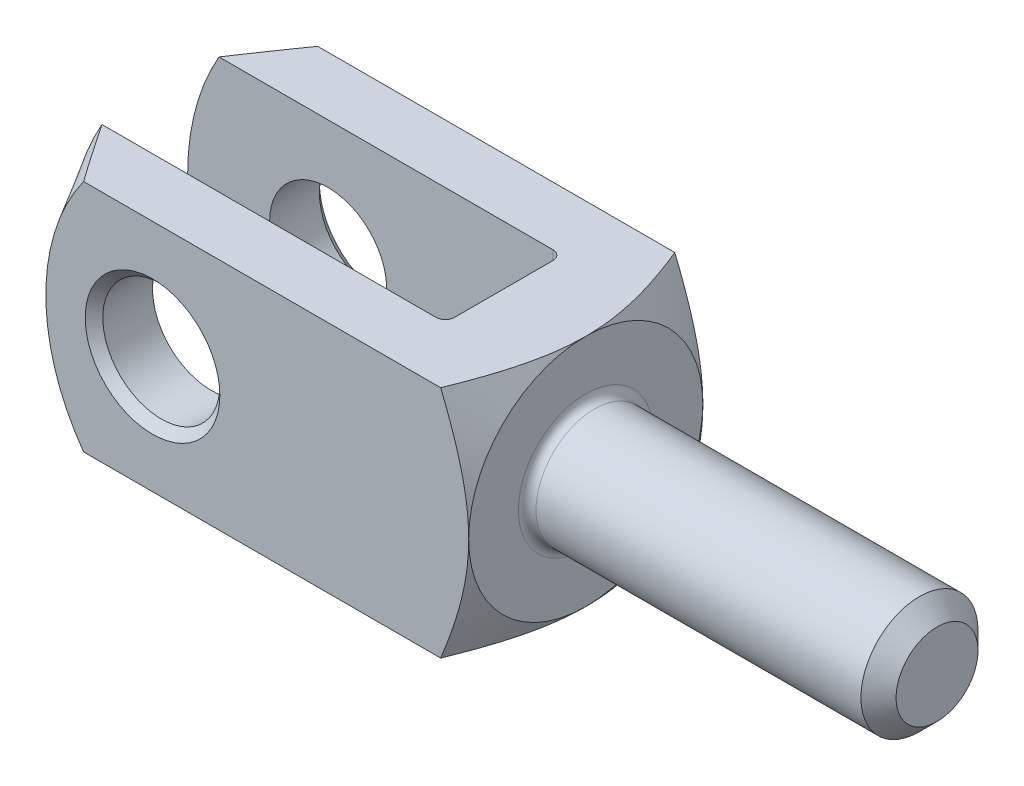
SolidWorks part; units mm, degrees
ref_plane "Front Plane" through (0, 0, 0) normal (0, 0, 1) x (1, 0, 0)
ref_plane "Top Plane" through (0, 0, 0) normal (0, 1, 0) x (1, 0, 0)
ref_plane "Right Plane" through (0, 0, 0) normal (1, 0, 0) x (0, 0, -1)
sketch "Sketch1" plane through (0, 0, 0) normal (1, 0, 0) x (0, 0, -1)
  line L0 (0, 0) -> (0, 50000) construction
  line L1 (0, 0) -> (50000, 0) construction
  line L2 (-10, -10) -> (-10, 10)
  line L3 (-10, 10) -> (10, 10)
  line L4 (10, -10) -> (10, 10)
  line L5 (-10, -10) -> (10, -10)
  point P9 (0, 10)
  point P11 (10, 0)
  point P12 (-10, 0)
  dimension "D1" = 20
  dimension "D2" = 20
extrude "Extrude1" add sketch "Sketch1" against normal blind 69
sketch "Sketch2" plane through (0, 0, 0) normal (1, 0, 0) x (0, 0, -1)
  circle A0 centre (0, 0) radius 5
  circle A1 centre (0, 0) radius 20
  dimension "D1" = 10
  dimension "D2" = 40
extrude "Extrude2" cut sketch "Sketch2" against normal blind 30
sketch "Sketch3" plane through (0, 0, 10) normal (0, 0, 1) x (1, 0, 0)
  circle A0 centre (-57, 0) radius 5
  dimension "D1" = 10
  dimension "D2" = 57
extrude "Extrude3" cut sketch "Sketch3" against normal through all
sketch "Sketch4" plane through (0, 10, 0) normal (0, 1, 0) x (1, 0, 0)
  line L0 (0, 0) -> (-50000, 0) construction
  line L1 (-69, -5) -> (-69, 5)
  line L2 (-69, 10) -> (-69, -10) construction
  line L3 (-69, 5) -> (-37, 5)
  line L4 (-37, 5) -> (-37, -5)
  line L5 (-57, 10) -> (-57, -10) construction
  line L6 (-69, -5) -> (-37, -5)
  point P7 (-57, 0)
  point P13 (-37, 0)
  point P14 (-69, 0)
  dimension "D1" = 20
  dimension "D2" = 10
extrude "Extrude4" cut sketch "Sketch4" against normal through all
fillet "Fillet1" radius 0.8 2 edges at (-37, 0, 5) (-37, 0, -5)
fillet "Fillet2" radius 0.75 1 edges at (-30, 0, -5)
chamfer "Chamfer2" distance 0.75 angle 45 2 edges at (-52, 0, -10) (-52, 0, 10)
sketch "Sketch6" plane through (0, 0, 0) normal (0, 0, 1) x (1, 0, 0)
  line L0 (-30, -10) -> (-30, -20)
  line L1 (-30, -20) -> (-35.7735, -20)
  line L2 (-35.7735, -20) -> (-30, -10)
  dimension "D1" = 30
  dimension "D2" = 20
revolve "Cut-Revolve1" cut sketch "Sketch6" angle 360 about axis through (-30, 0, 0) along (1, 0, 0)
sketch "Sketch7" plane through (0, 0, 0) normal (0, 1, 0) x (1, 0, 0)
  line L0 (-66.1132, -10) -> (-69, -5)
  line L1 (-69, 5) -> (-66.1132, 10)
  line L2 (-66.1132, 10) -> (-89, 10)
  line L3 (-69, 5) -> (-69, -5)
  line L4 (-89, 10) -> (-89, -10)
  line L5 (-89, -10) -> (-66.1132, -10)
  line L6 (-69, 10) -> (-32.3915, 10) construction
  line L7 (-69, -10) -> (-32.3915, -10) construction
  line L8 (-49, 0.6162) -> (-49, 50000.6162) construction
  dimension "D1" = 120
  dimension "D2" = 20
  dimension "D3" = 20
revolve "Cut-Revolve2" cut sketch "Sketch7" angle 180 about L8
chamfer "Chamfer3" distance 1.5 angle 45 1 edges at (0, 0, -5)
equation "\"D2@Sketch1\" = \"D1@Sketch1\""
equation "\"D2@Sketch2\" = \"D1@Sketch1\"/.5"
equation "\"D2@Sketch6\" = \"D1@Sketch1\""
equation "\"D2@Sketch7\" = \"D1@Sketch1\""
equation "\"D3@Sketch7\" = \"D1@Sketch1\""
